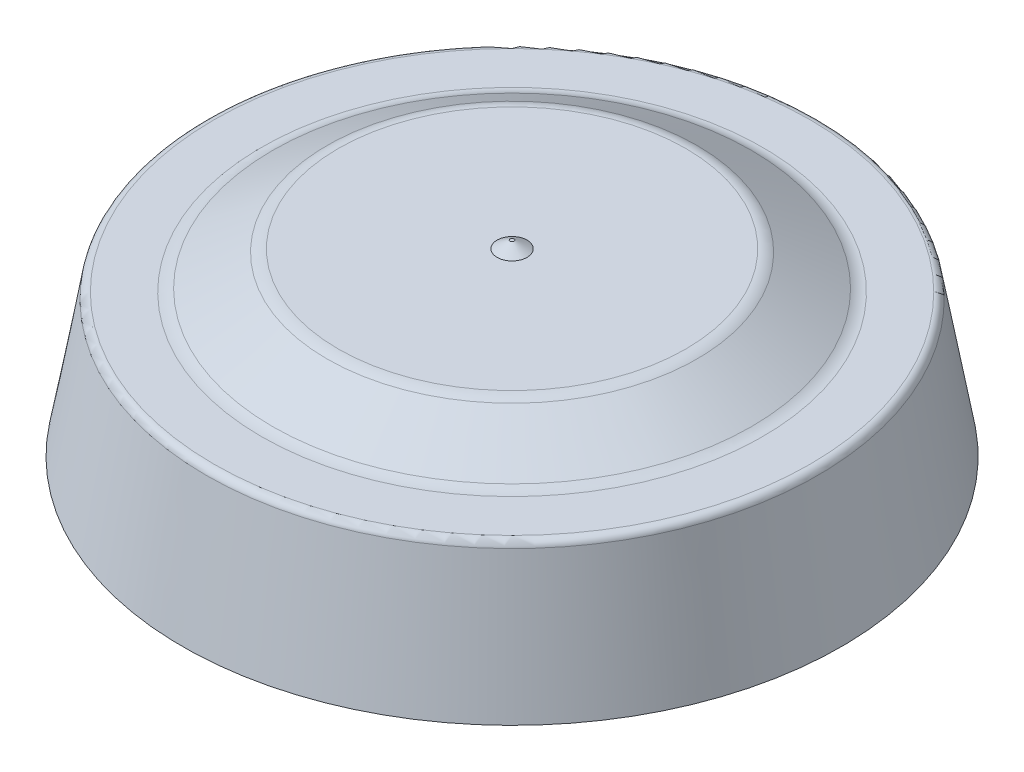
SolidWorks part; units mm, degrees
ref_plane "Front Plane" through (0, 0, 0) normal (0, 0, 1) x (1, 0, 0)
ref_plane "Top Plane" through (0, 0, 0) normal (0, 1, 0) x (1, 0, 0)
ref_plane "Right Plane" through (0, 0, 0) normal (1, 0, 0) x (0, 0, -1)
sketch "Sketch1" plane through (0, 0, 0) normal (1, 0, 0) x (0, 0, -1)
  line L0 (0, 12) -> (12, 12)
  line L3 (20.3249, 9.5) -> (22, 0)
  line L4 (22, 0) -> (0, 0)
  line L5 (0, 0) -> (0, 12)
  line L6 (12, 12) -> (16.3249, 9.5)
  line L7 (16.3249, 9.5) -> (20.3249, 9.5)
  dimension "D1" = 22
  dimension "D2" = 12
  dimension "D3" = 12
  dimension "D4" = 80
  dimension "D5" = 4
  dimension "D6" = 2.5
revolve "Revolve1" add sketch "Sketch1" angle 360 about L5
fillet "Fillet2" radius 1.5 2 edges at (0, 9.5, -16.3249) (0, 12, -12)
shell "Shell2" thickness 2
fillet "Fillet3" radius 0.5 1 edges at (0, 9.5, -20.3249)
sketch "Sketch3" plane through (0, 12, 0) normal (0, 1, 0) x (1, 0, 0)
  circle A0 centre (0, 0) radius 1
  dimension "D1" = 2
extrude "Boss-Extrude1" add sketch "Sketch3" along normal blind 0.5 draft 60
sketch "Sketch4" plane through (0, 0, 0) normal (0, -1, 0) x (1, 0, 0)
  point P0 (0, 0)
